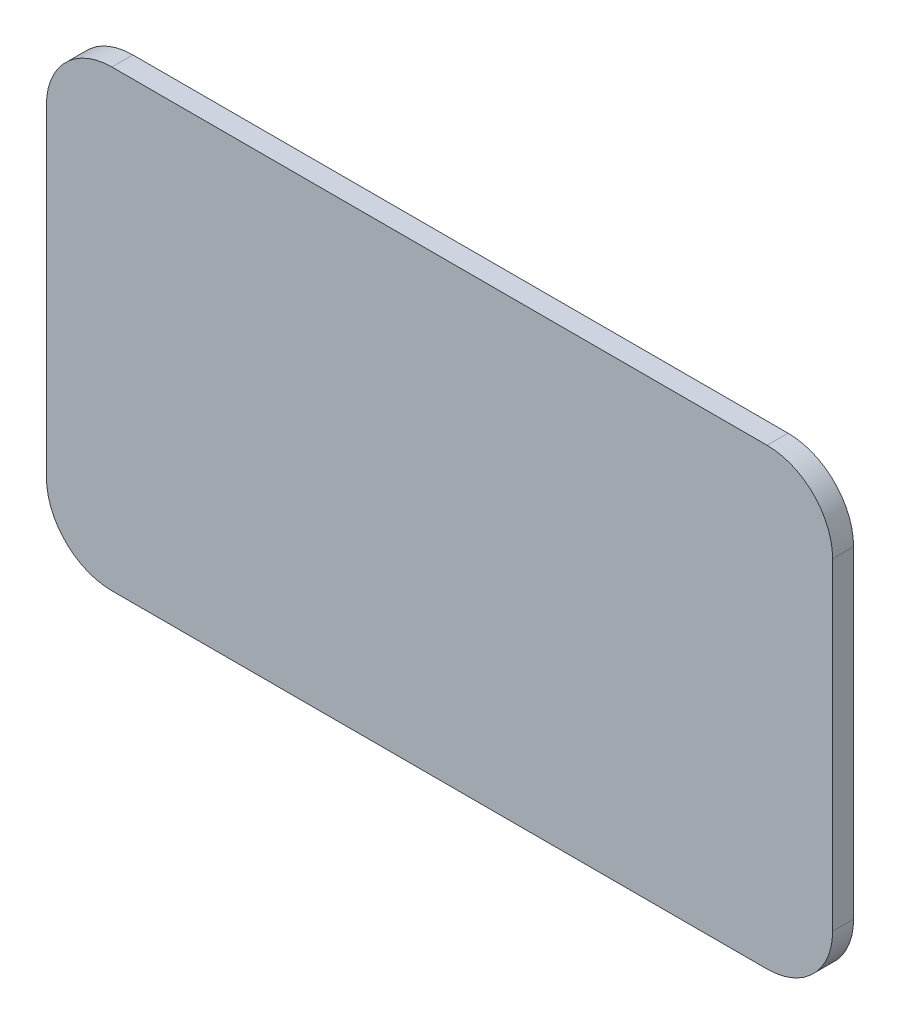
SolidWorks part; units mm, degrees
ref_plane "前视基准面" through (0, 0, 0) normal (0, 0, 1) x (1, 0, 0)
ref_plane "上视基准面" through (0, 0, 0) normal (0, 1, 0) x (1, 0, 0)
ref_plane "右视基准面" through (0, 0, 0) normal (1, 0, 0) x (0, 0, -1)
other "Configuration Table"
sketch "草图1" plane through (0, 0, 0) normal (0, 0, 1) x (1, 0, 0)
  line L0 (-20.273, -10.128) -> (29.727, -10.128)
  line L1 (34.727, -5.128) -> (34.727, 19.491)
  line L2 (29.727, 24.491) -> (-20.273, 24.491)
  line L3 (-25.273, 19.491) -> (-25.273, -5.128)
  arc A0 (29.727, -10.128) -> (34.727, -5.128) centre (29.727, -5.128) ccw
  arc A1 (34.727, 19.491) -> (29.727, 24.491) centre (29.727, 19.491) ccw
  arc A2 (-20.273, 24.491) -> (-25.273, 19.491) centre (-20.273, 19.491) ccw
  arc A3 (-25.273, -5.128) -> (-20.273, -10.128) centre (-20.273, -5.128) ccw
  dimension "D1" = 5
  dimension "D2" = 34.727
  dimension "D3" = 25.273
  dimension "D4" = 24.491
  dimension "D5" = 10.128
extrude "Undrilled_original_outline" add sketch "草图1" along normal blind 1.6
